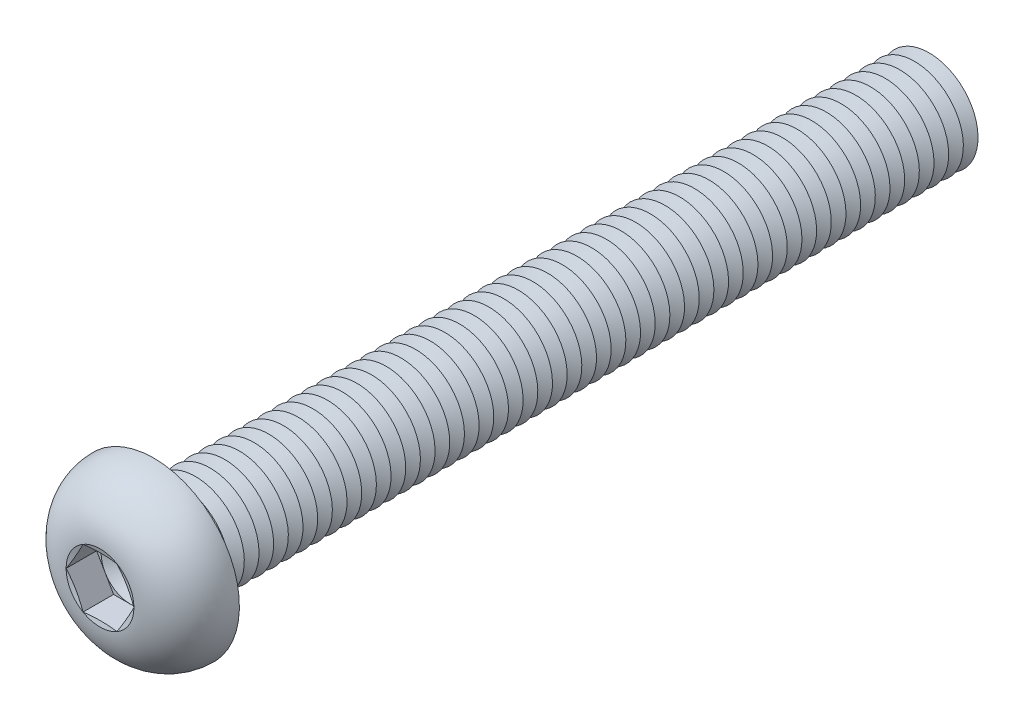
SolidWorks part; units mm, degrees
ref_plane "Front Plane" through (0, 0, 0) normal (0, 0, 1) x (1, 0, 0)
ref_plane "Top Plane" through (0, 0, 0) normal (0, 1, 0) x (1, 0, 0)
ref_plane "Right Plane" through (0, 0, 0) normal (1, 0, 0) x (0, 0, -1)
sketch "Sketch1" plane through (0, 0, 0) normal (1, 0, 0) x (0, 0, -1)
  line L0 (0, 5) -> (0, 8.75)
  line L3 (0, 5) -> (80, 5)
  line L4 (80, 5) -> (80, 0)
  line L5 (80, 0) -> (-5.5, 0) construction
  line L6 (-5.5, 0) -> (80, 0)
  line L7 (-5.5, 3.4641) -> (-5.5, 1.732) construction
  line L8 (-5.5, 1.732) -> (-5.5, 0)
  line L9 (-5.5, 3.4641) -> (-5.0359, 1.732)
  line L10 (-5.0359, 1.732) -> (-5.5, 1.732)
  line L11 (80, 0) -> (22.7481, 0) construction
  line L12 (0, 8.75) -> (-5.5, 8.75) construction
  arc A1 (0, 8.75) -> (-5.5, 3.4641) centre (0, 3.2457) ccw
  point P8 (80, 2.5)
  dimension "D1" = 17.5
  dimension "D2" = 10
  dimension "D3" = 5.5
  dimension "D4" = 6.9282
  dimension "D5" = 80
  dimension "D6" = 15
revolve "Revolve1" add sketch "Sketch1" angle 360 about L5
fillet "Fillet1" radius 0.75 1 edges at (0, 5, 0)
sketch "Sketch2" plane through (0, 0, 0) normal (1, 0, 0) x (0, 0, -1)
  line L0 (79.25, 5) -> (80.75, 5)
  line L1 (80, 5) -> (0.75, 5) construction
  line L2 (80.75, 5) -> (80, 3.701)
  line L3 (80, -5) -> (80, 5) construction
  line L4 (80, 3.701) -> (79.25, 5)
  dimension "D1" = 1.5
revolve "Cut-Revolve1" cut sketch "Sketch2" angle 360 about axis through (0, 0, -80) along (0, 0, -1)
pattern_linear "LPattern1" count 53 spacing 1.5 along (0, 0, 1) of "Cut-Revolve1"
sketch "Sketch3" plane through (0, 0, 5.5) normal (0, 0, 1) x (1, 0, 0)
  line L7 (1.732, 3) -> (-1.7321, 3)
  line L8 (-1.7321, 3) -> (-3.4641, 0)
  line L9 (-3.4641, 0) -> (-1.732, -3)
  line L10 (-1.732, -3) -> (1.732, -3)
  line L11 (1.732, -3) -> (3.4641, 0)
  line L12 (3.4641, 0) -> (1.732, 3)
  circle A0 centre (0, 0) radius 3 construction
  circle A3 centre (0, 0) radius 3.4641 construction
extrude "Cut-Extrude1" cut sketch "Sketch3" against normal blind 3.12
sketch "Sketch4" plane through (0, 0, 2.38) normal (0, 0, 1) x (1, 0, 0)
  line L1 (1.732, 3) -> (-1.7321, 3) construction
  circle A0 centre (0, 0) radius 3
extrude "Cut-Extrude2" cut sketch "Sketch4" against normal through all draft 60
